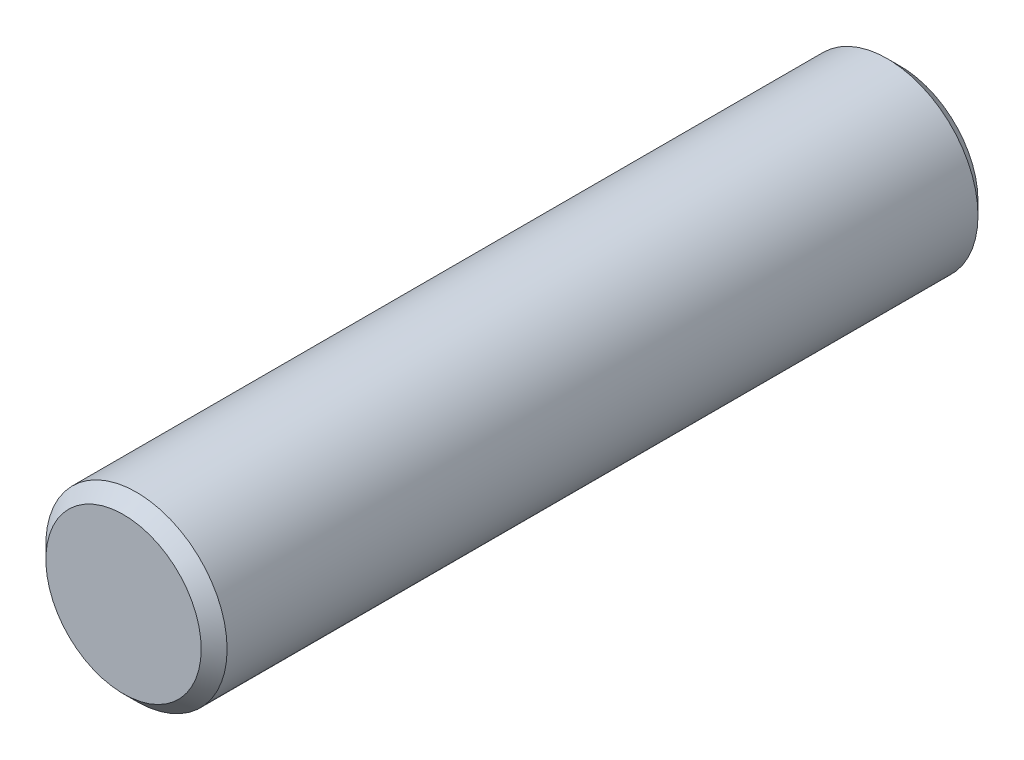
SolidWorks part; units mm, degrees
ref_plane "Plan1" through (0, 0, 0) normal (0, 0, 1) x (1, 0, 0)
ref_plane "Plan2" through (0, 0, 0) normal (0, 1, 0) x (1, 0, 0)
ref_plane "Plan3" through (0, 0, 0) normal (1, 0, 0) x (0, 0, -1)
sketch "Esquisse1" plane through (0, 0, 0) normal (0, 0, 1) x (1, 0, 0)
  circle A0 centre (0, 0) radius 3.5
  dimension "D1" = 7
extrude "Base-Extrusion" add sketch "Esquisse1" along normal blind 30
chamfer "Chanfrein1" distance 0.5 angle 45
